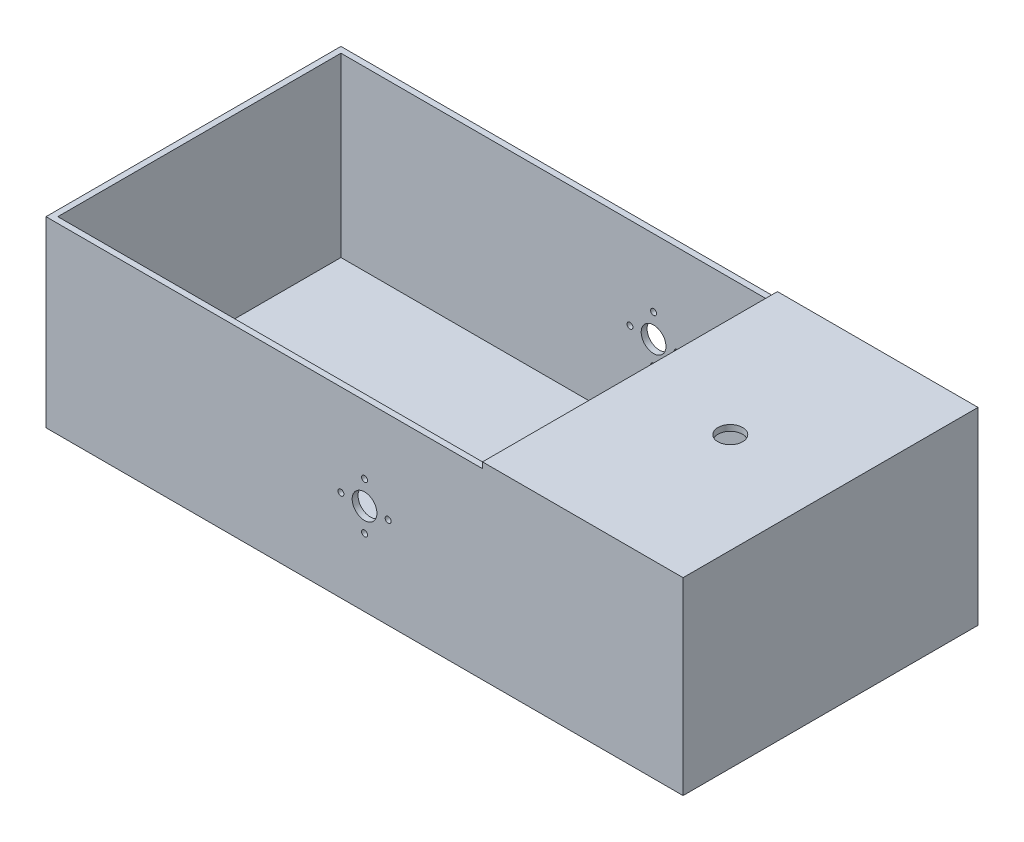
SolidWorks part; units mm, degrees
ref_plane "Front Plane" through (0, 0, 0) normal (0, 0, 1) x (1, 0, 0)
ref_plane "Top Plane" through (0, 0, 0) normal (0, 1, 0) x (1, 0, 0)
ref_plane "Right Plane" through (0, 0, 0) normal (1, 0, 0) x (0, 0, -1)
sketch "Sketch1" plane through (0, 0, 0) normal (0, 1, 0) x (1, 0, 0)
  line L1 (270, -125) -> (-270, -125)
  line L2 (270, -125) -> (270, 125)
  line L3 (270, 125) -> (-270, 125)
  line L4 (-270, -125) -> (-270, 125)
  line L5 (270, -125) -> (-270, 125) construction
  line L6 (270, 125) -> (-270, -125) construction
  point P0 (0, 0)
  dimension "D1" = 540
  dimension "D2" = 250
extrude "Boss-Extrude1" add sketch "Sketch1" along normal blind 5
sketch "Sketch2" plane through (0, 5, 0) normal (0, 1, 0) x (1, 0, 0)
  line L0 (270, -125) -> (270, 125) construction
  line L1 (-270, -125) -> (270, -125) construction
  line L2 (-270, 125) -> (-270, -125) construction
  line L3 (270, 125) -> (-270, 125) construction
  line L4 (270, -125) -> (270, 125)
  line L5 (-270, -125) -> (270, -125)
  line L6 (-270, 125) -> (-270, -125)
  line L7 (270, 125) -> (-270, 125)
  line L8 (265, 120) -> (-265, 120)
  line L9 (-265, 120) -> (-265, -120)
  line L10 (-265, -120) -> (265, -120)
  line L11 (265, -120) -> (265, 120)
  dimension "D1" = 5
extrude "Boss-Extrude2" add sketch "Sketch2" along normal blind 150
sketch "Sketch3" plane through (0, 155, 0) normal (0, 1, 0) x (1, 0, 0)
  line L0 (-270, -125) -> (270, -125) construction
  line L1 (270, 125) -> (100, 125)
  line L2 (270, 125) -> (270, -125)
  line L3 (270, -125) -> (100, -125)
  line L4 (100, 125) -> (100, -125)
  line L5 (270, 125) -> (100, -125) construction
  line L6 (270, -125) -> (100, 125) construction
  point P4 (185, 0)
extrude "Boss-Extrude3" add sketch "Sketch3" along normal blind 5
sketch "Sketch5" plane through (0, 160, 0) normal (0, 1, 0) x (1, 0, 0)
  circle A0 centre (185, 0) radius 10.5
extrude "Cut-Extrude1" cut sketch "Sketch5" against normal blind 10
sketch "Sketch7" plane through (0, 0, 125) normal (0, 0, 1) x (1, 0, 0)
  line L0 (0, 0) -> (0, 155) construction
  line L1 (-270, 155) -> (100, 155) construction
  circle A0 centre (0, 77.5) radius 10.5
  circle A1 centre (0, 77.5) radius 20 construction
  circle A2 centre (0, 97.5) radius 2.5
  circle A3 centre (20, 77.5) radius 2.5
  circle A4 centre (-20, 77.5) radius 2.5
  circle A5 centre (0, 57.5) radius 2.5
extrude "Cut-Extrude2" cut sketch "Sketch7" against normal through all
